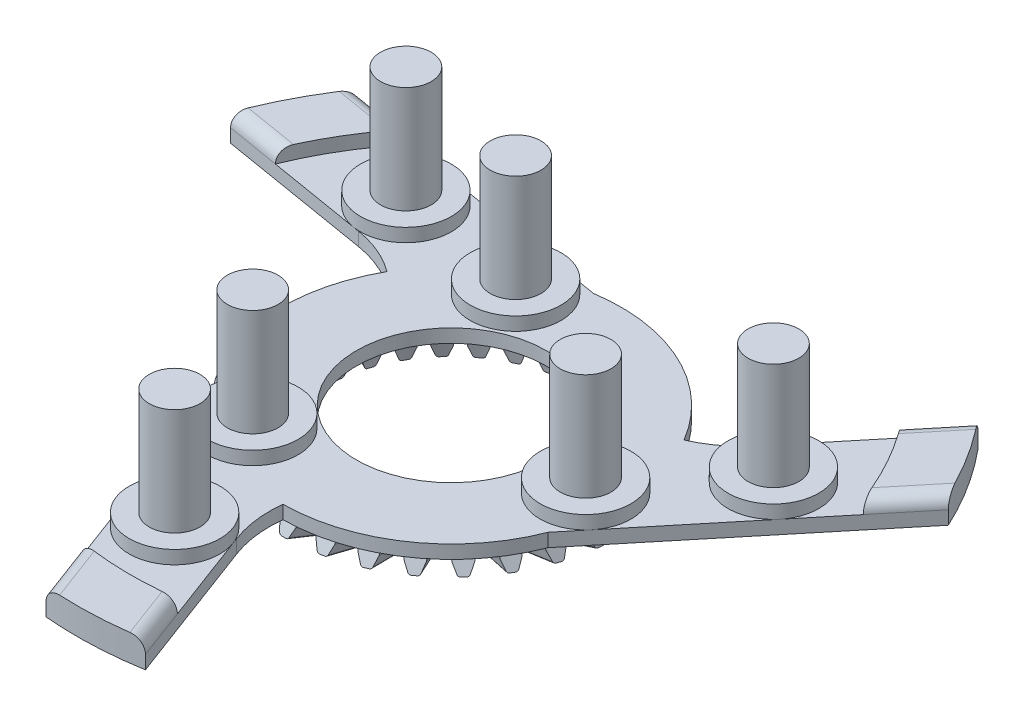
SolidWorks part; units mm, degrees
ref_plane "Front Plane" through (0, 0, 0) normal (0, 0, 1) x (1, 0, 0)
ref_plane "Top Plane" through (0, 0, 0) normal (0, 1, 0) x (1, 0, 0)
ref_plane "Right Plane" through (0, 0, 0) normal (1, 0, 0) x (0, 0, -1)
sketch "Sketch1" plane through (0, 0, 0) normal (0, 1, 0) x (1, 0, 0)
  circle A0 centre (-92.964, 71.374) radius 12.065
  circle A1 centre (-30.3949, 60.96) radius 12.065
  dimension "D1" = 24.13
  dimension "D4" = 63.4299
  dimension "D5" = 60.96
  dimension "D2" = 92.964
  dimension "D3" = 71.374
extrude "Boss-Extrude1" add sketch "Sketch1" along normal blind 57.15
sketch "Sketch2" plane through (0, 0, 0) normal (0, -1, 0) x (-1, 0, 0)
  line L0 (12.2974, 36.0608) -> (166.7274, 61.7642)
  line L2 (145.6155, 102.0243) -> (12.2974, 79.8349)
  line L3 (12.2974, 79.8349) -> (-30.4681, 22.8758)
  line L4 (92.964, 71.374) -> (30.3949, 60.96) construction
  arc A0 (-30.4681, 22.8758) -> (12.2974, 36.0608) centre (0, 0) ccw
  arc A1 (166.7274, 61.7642) -> (145.6155, 102.0243) centre (0, 0) ccw
  dimension "D3" = 177.8
  dimension "D4" = 38.1
  dimension "D1" = 21.59
  dimension "D2" = 21.59
extrude "Boss-Extrude2" add sketch "Sketch2" along normal blind 6.35
sketch "Sketch3" plane through (0, 0, 0) normal (0, 1, 0) x (1, 0, 0)
  line L0 (-145.6155, 102.0243) -> (-12.2974, 79.8349) construction
  circle A0 centre (-92.964, 71.374) radius 21.59
  circle A1 centre (-30.3949, 60.96) radius 21.59
  circle A2 centre (-30.3949, 60.96) radius 12.065 construction
  circle A3 centre (-92.964, 71.374) radius 12.065 construction
extrude "Boss-Extrude3" add sketch "Sketch3" along normal blind 6.35 contours A0 M4 | A1
sketch "Sketch4" plane through (0, 0, 0) normal (0, 1, 0) x (1, 0, 0)
  line L0 (-145.6155, 102.0243) -> (-117.2886, 97.3096)
  line L1 (-145.6155, 102.0243) -> (-89.4193, 92.671) construction
  line L3 (-96.5087, 50.077) -> (-166.7274, 61.7642) construction
  line L4 (-141.1347, 57.5045) -> (-166.7274, 61.7642)
  arc A0 (-166.7274, 61.7642) -> (-145.6155, 102.0243) centre (0, 0) cw
  arc A1 (-145.6155, 102.0243) -> (-166.7274, 61.7642) centre (0, 0) ccw construction
  arc A2 (-117.2886, 97.3096) -> (-141.1347, 57.5045) centre (0, 0) ccw
  dimension "D1" = 304.8
extrude "Boss-Extrude4" add sketch "Sketch4" along normal blind 6.35
fillet "Fillet3" radius 6.35 2 edges at (-131.452, 6.35, -99.6669) (-153.931, 6.35, -59.6343)
pattern_circular "CirPattern15" count 3 over 360 about axis through (0, 0, 0) along (0, 1, 0) of "Boss-Extrude1", "Boss-Extrude2"
pattern_circular "CirPattern16" count 3 over 360 about axis through (0, 0, 0) along (0, 1, 0) of "Boss-Extrude1", "Boss-Extrude3"
pattern_circular "CirPattern17" count 3 over 360 about axis through (0, 0, 0) along (0, 1, 0) of "CirPattern16", "Boss-Extrude4", "Fillet3"
fillet "Fillet9" radius 54.61 3 edges at (-12.2974, -3.175, -36.0608) (37.3783, -3.175, 7.3806) (-25.0809, -3.175, 28.6803)
sketch "Sketch7" plane through (0, 0, 0) normal (0, 1, 0) x (1, 0, 0)
  circle A0 centre (0, 0) radius 44.45
  dimension "D1" = 88.9
extrude "Cut-Extrude2" cut sketch "Sketch7" against normal blind 12.7
sketch "Sketch8" plane through (0, -6.35, 0) normal (0, -1, 0) x (-1, 0, 0)
  circle A0 centre (0, 0) radius 80.7764
  circle A1 centre (0, 0) radius 42.3042
extrude "Boss-Extrude6" add sketch "Sketch8" against normal blind 6.35
sketch "Sketch9" plane through (0, -6.35, 0) normal (0, -1, 0) x (1, 0, 0)
  circle A0 centre (0, 0) radius 76.2
  circle A1 centre (0, 0) radius 57.15
  circle A2 centre (0, 0) radius 42.3042 construction
  dimension "D1" = 152.4
  dimension "D2" = 114.3
extrude "Boss-Extrude7" add sketch "Sketch9" along normal blind 7.62
chamfer "Chamfer1" distance 7.62 distance2 19.05 1 edges at (0, -13.97, -76.2)
ref_plane "Plane2" through (0, -31.75, -12.7) normal (0, -0.9285, -0.3714) x (-1, 0, 0)
ref_plane "Plane5" through (0, -31.75, 12.7) normal (0, -0.9285, 0.3714) x (-1, 0, 0)
ref_plane "Plane6" through (0, 0, 0) normal (0, 0.3714, 0.9285) x (1, 0, 0)
sketch "Sketch12" plane through (0, 0, 0) normal (0, 0.3714, 0.9285) x (1, 0, 0)
  line L0 (4.445, -34.1315) -> (-4.445, -34.1315)
  line L1 (-4.445, -34.1315) -> (-3.7732, -37.9415)
  line L2 (-3.7732, -37.9415) -> (-1.9242, -43.0215)
  line L3 (-1.9242, -43.0215) -> (1.9242, -43.0215)
  line L4 (1.9242, -43.0215) -> (3.7732, -37.9415)
  line L5 (3.7732, -37.9415) -> (4.445, -34.1315)
  ellipse E1 centre (0, -12.9708) end of major axis (-57.15, -12.9708) minor radius 21.225 construction
  dimension "D1" = 8.89
  dimension "D2" = 3.81
  dimension "D3" = 5.08
  dimension "D4" = 80
  dimension "D5" = 110
extrude "Boss-Extrude9" add sketch "Sketch12" along normal blind 68.58
fillet "Fillet12" radius 1.27 2 edges at (1.9242, -27.2095, 47.8152) (-1.9242, -27.2095, 47.8152)
pattern_circular "CirPattern20" count 30 over 360 about axis through (0, 0, 0) along (0, 1, 0) of "Boss-Extrude9"
sketch "Sketch14" plane through (0, -6.35, 0) normal (0, -1, 0) x (-1, 0, 0)
  circle A0 centre (0, 0) radius 57.15
  circle A1 centre (0, 0) radius 57.15 construction
extrude "Cut-Extrude3" cut sketch "Sketch14" along normal blind 35.56 draft 10
fillet "Fillet13" radius 1.27 30 edges at (-50.582, -18.4166, -48.1335) (-53.1571, -18.4166, -45.2735) (-59.4841, -18.4166, -36.5651) (-61.4084, -18.4166, -33.2322) (-65.7866, -18.4166, -23.3986) (-66.9758, -18.4166, -19.7385) (-69.2138, -18.4166, -9.2095) (-69.6161, -18.4166, -5.3821) (-69.6161, -18.4166, 5.3821) (-69.2138, -18.4166, 9.2095) (-66.9758, -18.4166, 19.7385) (-65.7866, -18.4166, 23.3986) (-61.4084, -18.4166, 33.2322) (-53.1571, -18.4166, 45.2735) (-59.4841, -18.4166, 36.5651) (-50.582, -18.4166, 48.1335) (-42.5826, -18.4166, 55.3362) (-39.4691, -18.4166, 57.5982) (-30.147, -18.4166, 62.9804) (-26.6313, -18.4166, 64.5457) (-16.3939, -18.4166, 67.872) (-12.6295, -18.4166, 68.6721) (53.1571, -18.4166, 45.2735) (50.582, -18.4166, 48.1335) (42.5826, -18.4166, 55.3362) (39.4691, -18.4166, 57.5982) (30.147, -18.4166, 62.9804) (26.6313, -18.4166, 64.5457) (16.3939, -18.4166, 67.872) (12.6295, -18.4166, 68.6721)
fillet "Fillet14" radius 1.27 27 edges at (59.4841, -18.4166, 36.5651) (61.4084, -18.4166, 33.2322) (65.7866, -18.4166, 23.3986) (66.9758, -18.4166, 19.7385) (69.2138, -18.4166, 9.2095) (69.6161, -18.4166, 5.3821) (69.6161, -18.4166, -5.3821) (69.2138, -18.4166, -9.2095) (66.9758, -18.4166, -19.7385) (65.7866, -18.4166, -23.3986) (61.4084, -18.4166, -33.2322) (59.4841, -18.4166, -36.5651) (53.1571, -18.4166, -45.2735) (50.582, -18.4166, -48.1335) (42.5826, -18.4166, -55.3362) (39.4691, -18.4166, -57.5982) (30.147, -18.4166, -62.9804) (16.3939, -18.4166, -67.872) (12.6295, -18.4166, -68.6721) (1.9242, -18.4166, -69.7973) (-1.9242, -18.4166, -69.7973) (-12.6295, -18.4166, -68.6721) (-16.3939, -18.4166, -67.872) (-26.6313, -18.4166, -64.5457) (-30.147, -18.4166, -62.9804) (-39.4691, -18.4166, -57.5982) (-42.5826, -18.4166, -55.3362)
sketch "Sketch15" plane through (0, -6.35, 0) normal (0, -1, 0) x (1, 0, 0)
  circle A0 centre (0, 0) radius 45.085
  dimension "D1" = 90.17
extrude "Cut-Extrude4" cut sketch "Sketch15" against normal blind 7.62
